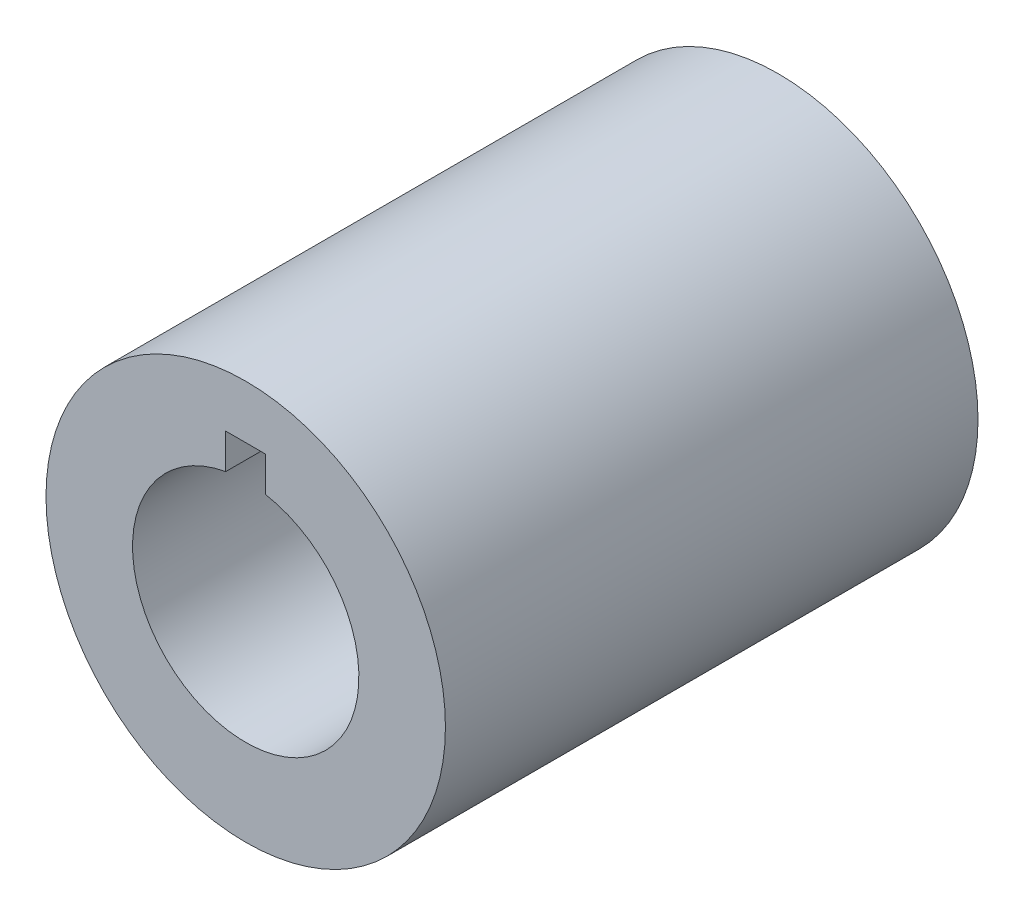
SolidWorks part; units mm, degrees
ref_plane "Front Plane" through (0, 0, 0) normal (0, 0, 1) x (1, 0, 0)
ref_plane "Top Plane" through (0, 0, 0) normal (0, 1, 0) x (1, 0, 0)
ref_plane "Right Plane" through (0, 0, 0) normal (1, 0, 0) x (0, 0, -1)
sketch "Sketch2" plane through (0, 0, 0) normal (0, 0, 1) x (1, 0, 0)
  line L2 (-1.5, 8.3666) -> (-1.5, 11)
  line L3 (-1.5, 11) -> (1.5, 11)
  line L4 (1.5, 8.3666) -> (1.5, 11)
  arc A0 (-1.5, 8.3666) -> (1.5, 8.3666) centre (0, 0) ccw
  circle A1 centre (0, 0) radius 15
  point P3 (0, 8.7726)
  point P5 (0, 11)
  dimension "D1" = 17
  dimension "D4" = 30
  dimension "D2" = 3
  dimension "D3" = 11
  dimension "D5" = 11
extrude "Boss-Extrude1" add sketch "Sketch2" along normal blind 40
